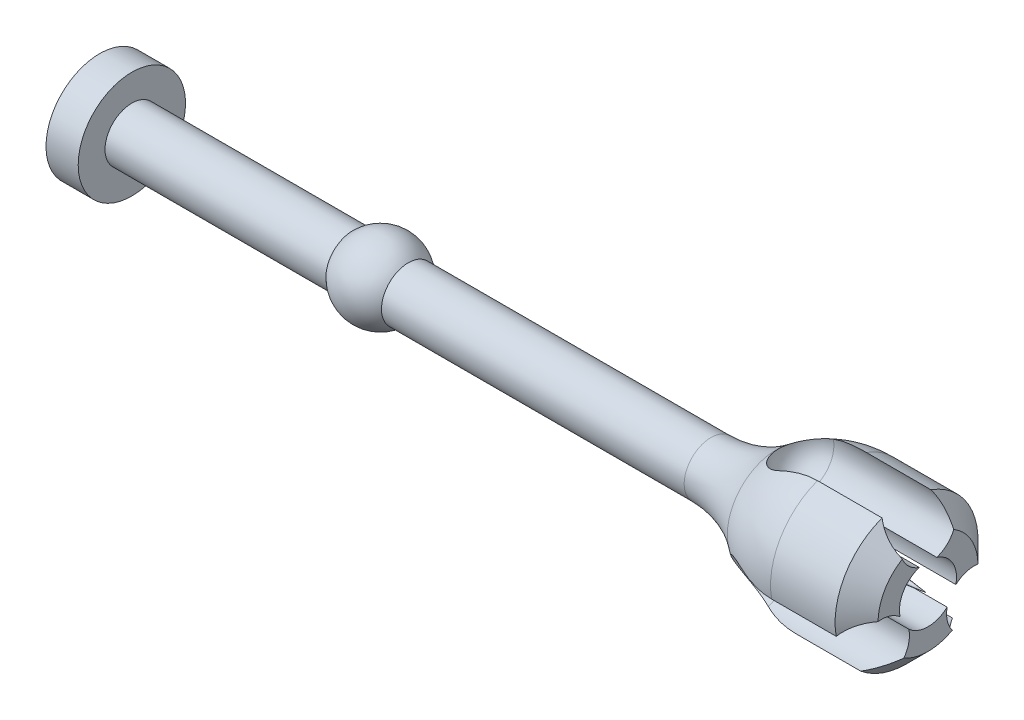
SolidWorks part; units mm, degrees
ref_plane "Plane1" through (0, 0, 0) normal (0, 0, 1) x (1, 0, 0)
ref_plane "Plane2" through (0, 0, 0) normal (0, 1, 0) x (1, 0, 0)
ref_plane "Plane3" through (0, 0, 0) normal (1, 0, 0) x (0, 0, -1)
sketch "Esquisse1" plane through (0, 0, 0) normal (0, 0, 1) x (1, 0, 0)
  line L0 (-250.9044, 12.5) -> (-250.9044, 25)
  line L1 (-265.9044, 0) -> (-265.9044, 27.9857) construction
  line L2 (52.9444, 13.294) -> (52.9444, 7.9481)
  line L3 (-250.9044, 12.5) -> (-147.9856, 12.5)
  line L4 (80, 33.294) -> (110.083, 33.294)
  line L5 (110.083, 33.294) -> (120.083, 23.294)
  line L6 (120.083, 23.294) -> (120.083, 13.294)
  line L7 (120.083, 13.294) -> (52.9444, 13.294)
  line L8 (52.9444, 0) -> (-260.3366, 0)
  line L9 (52.9444, 7.9481) -> (119.1399, 0)
  line L10 (119.1399, 0) -> (52.9444, 0)
  line L11 (-250.9044, 25) -> (-265.9044, 25)
  line L12 (-265.9044, 25) -> (-265.9044, 3.3413)
  line L13 (-149.3376, 0) -> (93.7998, 0) construction
  line L14 (-265.9044, 3.3413) -> (-276.903, 0)
  line L15 (-185.0381, 0) -> (-242.0491, 0) construction
  line L16 (-276.903, 0) -> (-260.3366, 0)
  line L17 (-122.082, 12.5) -> (18.9556, 12.5)
  arc A0 (18.9556, 12.5) -> (49.4778, 22.897) centre (18.9556, 62.5) ccw
  arc A1 (49.4778, 22.897) -> (80, 33.294) centre (80, -16.706) cw
  arc A2 (-122.082, 12.5) -> (-147.9856, 12.5) centre (-135.0338, 0) ccw
  dimension "D4" = 50
  dimension "D5" = 50
  dimension "D10" = 10
  dimension "D11" = 10
revolve "Base-Révolution" add sketch "Esquisse1" angle 360 about L13
sketch "Esquisse3" plane through (0, 0, 0) normal (0, 0, 1) x (1, 0, 0)
  line L0 (40.6426, 25) -> (125.3912, 25) construction
  line L1 (122.4463, 25) -> (122.4463, 38)
  line L2 (122.4463, 38) -> (63.2204, 38)
  line L3 (-149.3376, 0) -> (93.7998, 0) construction
  line L4 (122.4463, 25) -> (50.2204, 25)
  arc A0 (63.2204, 38) -> (50.2204, 25) centre (63.2204, 25) ccw
  dimension "D2" = 13
  dimension "D1" = 25
revolve "Enlever de la matière-Révolution1" cut sketch "Esquisse3" angle 360 about L0
pattern_circular "Répétition circulaire1" count 3 every 120 about axis through (0, 0, 0) along (1, 0, 0) of "Enlever de la matière-Révolution1"
sketch "Esquisse4" plane through (0, 0, 0) normal (0, 0, 1) x (1, 0, 0)
  line L0 (-101.6859, 0) -> (-255.105, 0) construction
  line L1 (-213.6609, 0) -> (-213.6609, 43.305) construction
  line L2 (-149.3376, 0) -> (93.7998, 0) construction
sketch "Esquisse5" plane through (0, 0, 0) normal (0, 0, 1) x (1, 0, 0)
  point P0 (-213.6609, 0)
